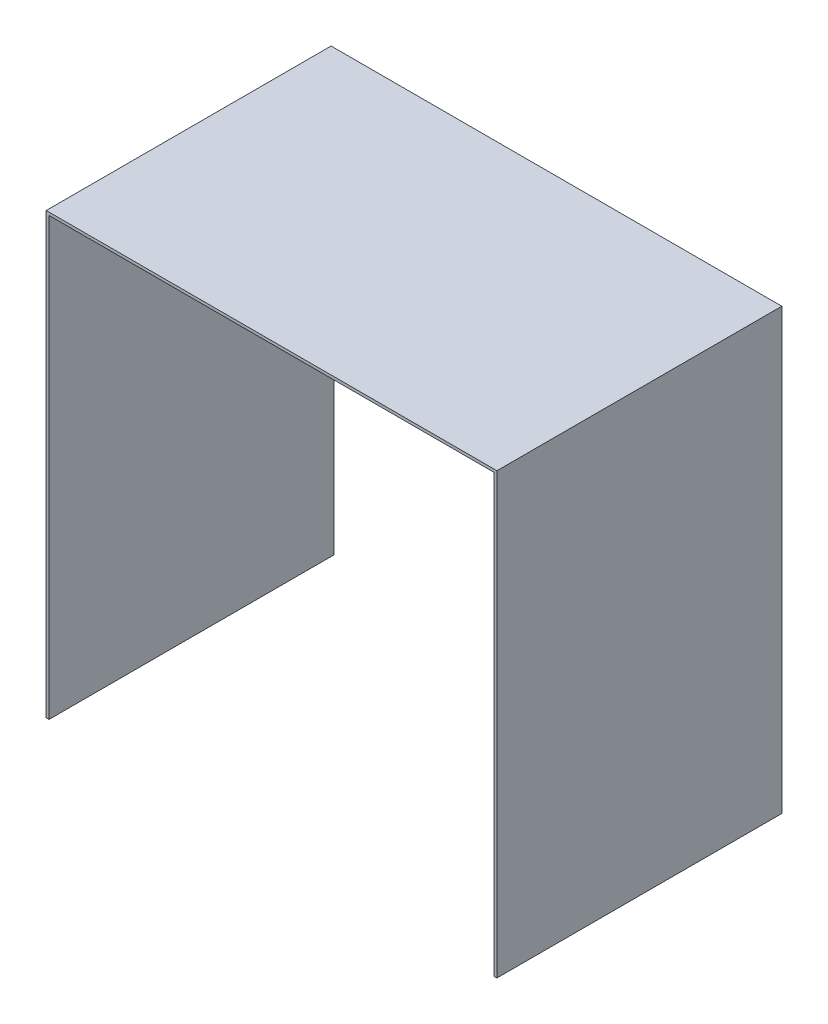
SolidWorks part; units mm, degrees
ref_plane "Plan de face" through (0, 0, 0) normal (0, 0, 1) x (1, 0, 0)
ref_plane "Plan de dessus" through (0, 0, 0) normal (0, 1, 0) x (1, 0, 0)
ref_plane "Plan de droite" through (0, 0, 0) normal (1, 0, 0) x (0, 0, -1)
sketch "Esquisse1" plane through (0, 0, 0) normal (0, 0, 1) x (1, 0, 0)
  line L2 (0, 0) -> (0, 1532)
  line L3 (0, 1532) -> (1562, 1532)
  line L4 (1562, 0) -> (1562, 1532)
  dimension "D1" = 1562
  dimension "D2" = 1532
extrude "Extru.-Mince1" add sketch "Esquisse1" along normal blind 1000 thin
